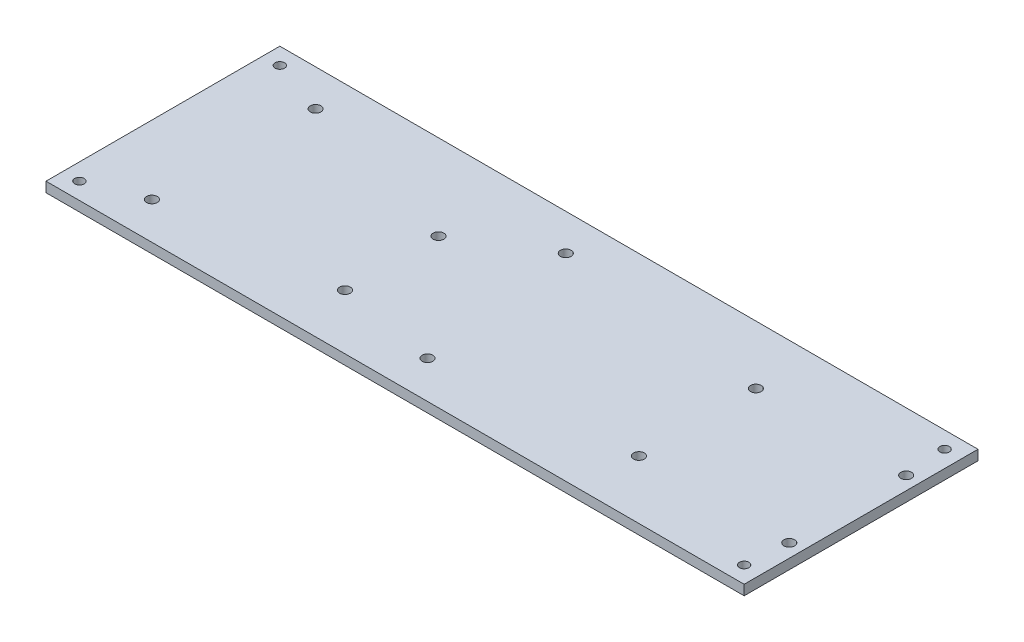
SolidWorks part; units mm, degrees
ref_plane "Front Plane" through (0, 0, 0) normal (0, 0, 1) x (1, 0, 0)
ref_plane "Top Plane" through (0, 0, 0) normal (0, 1, 0) x (1, 0, 0)
ref_plane "Right Plane" through (0, 0, 0) normal (1, 0, 0) x (0, 0, -1)
sketch "Sketch1" plane through (0, 0, 0) normal (0, 1, 0) x (1, 0, 0)
  line L1 (-104.5, 35) -> (104.5, 35)
  line L2 (-104.5, 35) -> (-104.5, -35)
  line L3 (-104.5, -35) -> (104.5, -35)
  line L4 (104.5, 35) -> (104.5, -35)
  line L5 (-104.5, 35) -> (104.5, -35) construction
  line L6 (-104.5, -35) -> (104.5, 35) construction
  point P0 (0, 0)
  dimension "D1" = 209
  dimension "D2" = 70
extrude "Boss-Extrude1" add sketch "Sketch1" along normal blind 3
sketch "Sketch2" plane through (0, 3, 0) normal (0, 1, 0) x (1, 0, 0)
  line L0 (-104.5, 0) -> (104.5, 0) construction
  line L1 (-104.5, 35) -> (-104.5, -35) construction
  line L2 (104.5, -35) -> (104.5, 35) construction
  line L3 (-97.9, 26.5) -> (-97.9, -26.5) construction
  line L8 (3.5, 26.5) -> (-104.5, -26.5) construction
  line L9 (3.5, -26.5) -> (-104.5, 26.5) construction
  line L10 (-82.9, 22.5) -> (-82.9, 26.5) construction
  circle A0 centre (-82.9, 24.1) radius 1.6
  circle A1 centre (-83.9, -23.9) radius 1.6
  circle A2 centre (-8, 24.1) radius 1.6
  circle A3 centre (-1.5, -23.8) radius 1.6
  circle A4 centre (-31.5, 9.5) radius 1.6
  circle A5 centre (-31.5, -18.5) radius 1.6
  point P6 (-50.5, 0)
  dimension "D4" = 3.2
  dimension "D7" = 3.2
  dimension "D10" = 3.2
  dimension "D13" = 3.2
  dimension "D14" = 3.2
  dimension "D17" = 3.2
  dimension "D1" = 108
  dimension "D2" = 53
  dimension "D5" = 15
  dimension "D8" = 14
extrude "Cut-Extrude1" cut sketch "Sketch2" against normal through all
sketch "Sketch3" plane through (0, 3, 0) normal (0, 1, 0) x (1, 0, 0)
  line L0 (-104.5, 0) -> (104.5, 0) construction
  line L1 (-104.5, 35) -> (-104.5, -35) construction
  line L2 (104.5, -35) -> (104.5, 35) construction
  line L8 (51.5, 21.5) -> (104.5, -21.5) construction
  line L9 (51.5, -21.5) -> (104.5, 21.5) construction
  circle A0 centre (55.5, 17.5) radius 1.6
  circle A2 centre (55.5, -17.5) radius 1.6
  circle A3 centre (100.5, 17.5) radius 1.6
  circle A4 centre (100.5, -17.5) radius 1.6
  point P6 (78, 0)
  dimension "D3" = 3.2
  dimension "D8" = 3.2
  dimension "D13" = 3.2
  dimension "D14" = 3.2
  dimension "D1" = 43
  dimension "D2" = 53
extrude "Cut-Extrude2" cut sketch "Sketch3" against normal through all
sketch "Sketch4" plane through (0, 3, 0) normal (0, 1, 0) x (1, 0, 0)
  line L0 (-104.5, 35) -> (-104.5, -35) construction
  line L1 (104.5, 35) -> (-104.5, 35) construction
  line L2 (0, -1.65) -> (0, 1.65) construction
  line L3 (-1.65, 0) -> (1.65, 0) construction
  circle A0 centre (-99.5, 30) radius 1.42
  circle A1 centre (99.5, 30) radius 1.42
  circle A2 centre (99.5, -30) radius 1.42
  circle A3 centre (99.5, -30) radius 1.42
  circle A4 centre (-99.5, -30) radius 1.42
  point P14 (-99.5, -30)
  dimension "D1" = 2.84
  dimension "D2" = 5
  dimension "D3" = 5
extrude "Cut-Extrude3" cut sketch "Sketch4" against normal through all contours A0 | A4 | A2 | A1
